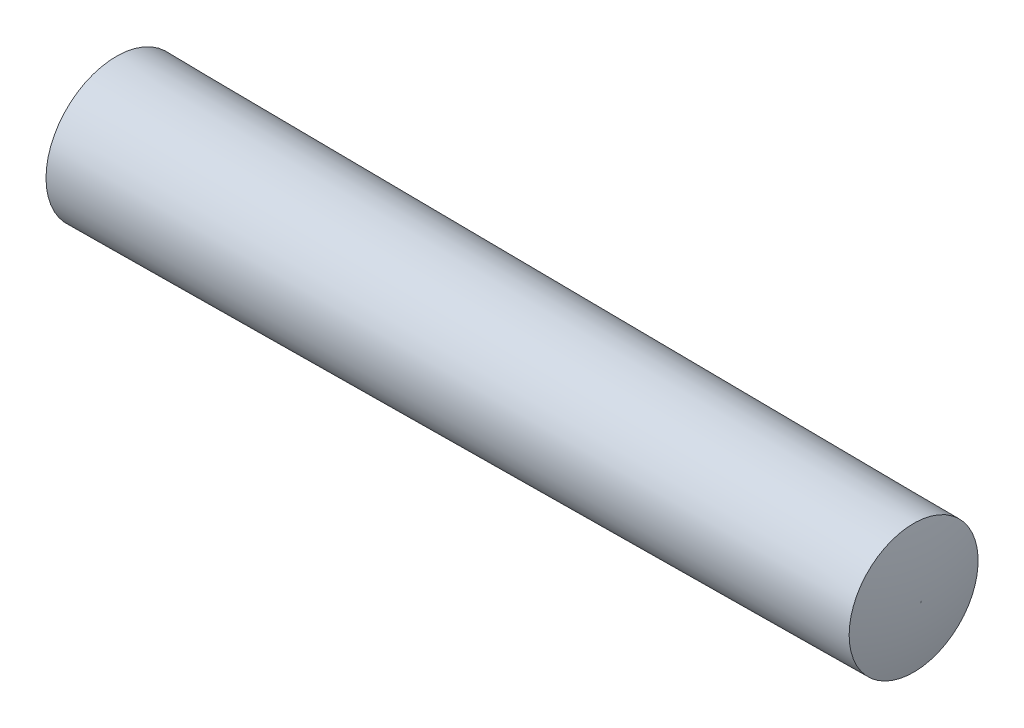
SolidWorks part; units mm, degrees
ref_plane "Plane1" through (0, 0, 0) normal (0, 0, 1) x (1, 0, 0)
ref_plane "Plane2" through (0, 0, 0) normal (0, 1, 0) x (1, 0, 0)
ref_plane "Plane3" through (0, 0, 0) normal (1, 0, 0) x (0, 0, -1)
sketch "Sketch1" plane through (0, 0, 0) normal (0, 0, 1) x (1, 0, 0)
  line L1 (-5.588, 0) -> (131.826, 0) construction
  line L2 (0, 0) -> (0, 0.0897)
  line L3 (0, 0) -> (103.6493, 0)
  line L4 (103.6493, 0) -> (103.6493, 0.0897)
  line L5 (102.7158, 8.219) -> (1.1158, 8.9662)
  arc A0 (0, 0.0897) -> (1.1158, 8.9662) centre (35.8648, 0.0897) cw
  arc A1 (103.6493, 0.0897) -> (102.7158, 8.219) centre (67.7845, 0.0897) ccw
  dimension "D2" = 0.0897
  dimension "D5" = 16.438
  dimension "D3" = 35.8648
  dimension "D4" = 35.8648
  dimension "D1" = 0.0897
  dimension "Length" = 101.6
  dimension "Diameter" = 17.9324
revolve "Base-Revolve" add sketch "Sketch1" angle 360 about L1
equation "\"D1@Sketch1\" = \"Diameter@Sketch1\" / 100 / 2"
equation "\"D2@Sketch1\" = \"Diameter@Sketch1\" / 100 / 2"
equation "\"D3@Sketch1\" = \"Diameter@Sketch1\" *2"
equation "\"D4@Sketch1\" = \"Diameter@Sketch1\" *2"
equation "\"D5@Sketch1\" = \"Diameter@Sketch1\" -  (\"Length@Sketch1\" * (1/48) * \"Diameter@Sketch1\")"
